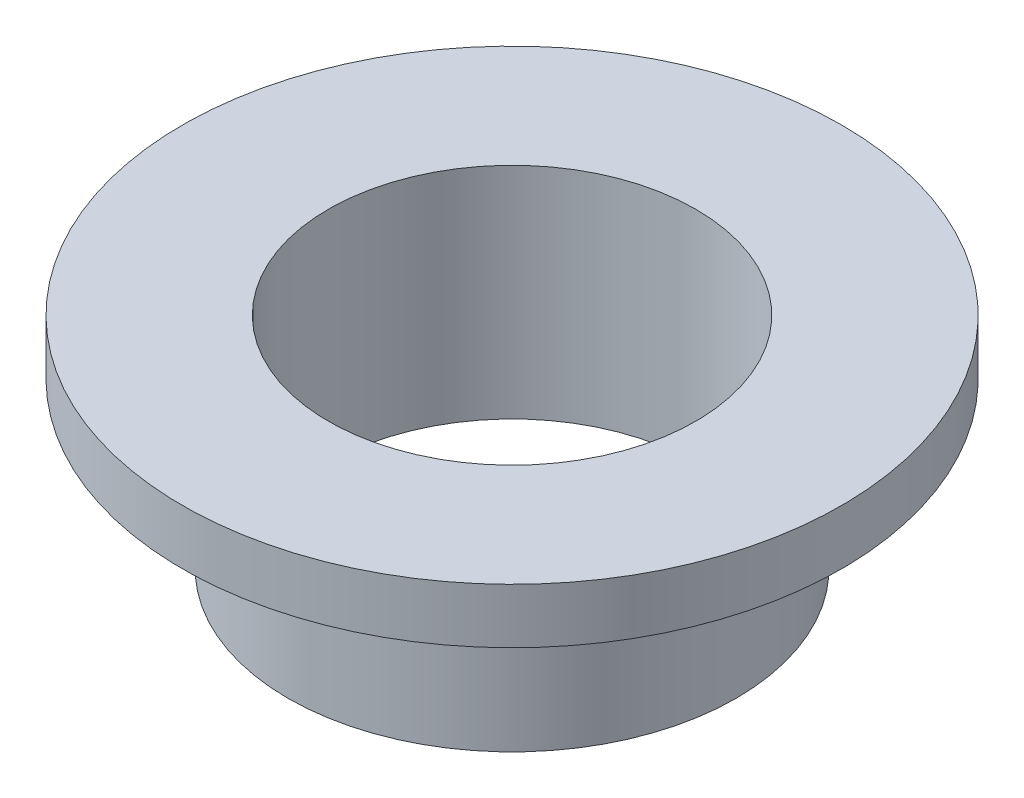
SolidWorks part; units mm, degrees
ref_plane "Front Plane" through (0, 0, 0) normal (0, 0, 1) x (1, 0, 0)
ref_plane "Top Plane" through (0, 0, 0) normal (0, 1, 0) x (1, 0, 0)
ref_plane "Right Plane" through (0, 0, 0) normal (1, 0, 0) x (0, 0, -1)
sketch "Sketch1" plane through (0, 0, 0) normal (0, 0, 1) x (1, 0, 0)
  line L0 (0, 0) -> (0, 60.3744) construction
  line L1 (-2.6543, 0.7938) -> (-4.7625, 0.7937)
  line L2 (-4.7625, 0.7937) -> (-4.7625, 0)
  line L3 (-4.7625, 0) -> (-3.2385, 0)
  line L4 (-3.2385, 0) -> (-3.2385, -2.3812)
  line L5 (-3.2385, -2.3812) -> (-2.6543, -2.3812)
  line L6 (-2.6543, -2.3812) -> (-2.6543, 0.7938)
  dimension "D1" = 5.3086
  dimension "D2" = 0.7937
  dimension "D3" = 6.477
  dimension "D4" = 9.525
  dimension "D5" = 3.175
revolve "Revolve1" add sketch "Sketch1" angle 360 about L0
